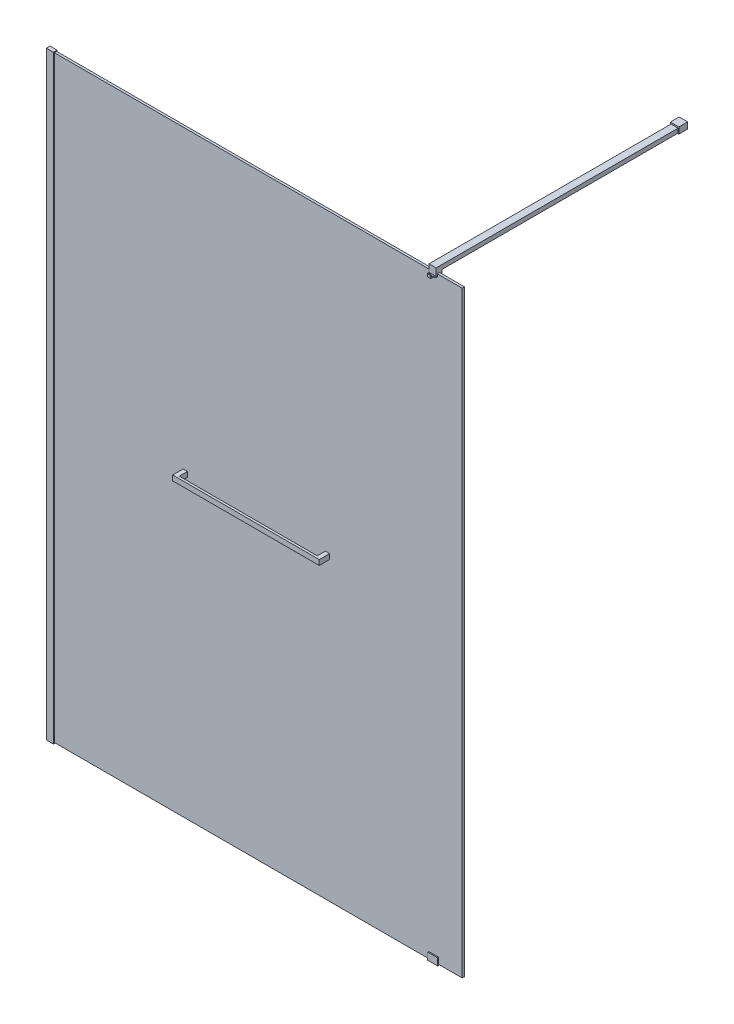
SolidWorks part; units mm, degrees
ref_plane "Płaszczyzna przednia" through (0, 0, 0) normal (0, 0, 1) x (1, 0, 0)
ref_plane "Płaszczyzna górna" through (0, 0, 0) normal (0, 1, 0) x (1, 0, 0)
ref_plane "Płaszczyzna prawa" through (0, 0, 0) normal (1, 0, 0) x (0, 0, -1)
sketch "Szkic1" plane through (0, 0, 0) normal (0, 1, 0) x (1, 0, 0)
  line L0 (0, 0) -> (0, 13.3)
  line L2 (0, 13.3) -> (25, 13.3)
  line L3 (25, 13.3) -> (25, 11.4)
  line L4 (25, 11.4) -> (11.45, 11.4)
  line L5 (11.45, 11.4) -> (11.45, 3.4)
  line L6 (11.45, 3.4) -> (25, 3.4)
  line L7 (25, 3.4) -> (25, 0)
  line L8 (25, 0) -> (0, 0)
  dimension "D1" = 13.3
  dimension "D4" = 1.9
  dimension "D5" = 8
  dimension "D6" = 3.4
  dimension "D7" = 13.55
  dimension "D8" = 25
extrude "Dodanie-wyciągnięcie1" add sketch "Szkic1" along normal blind 2100
sketch "Szkic2" plane through (0, 0, 0) normal (0, -1, 0) x (1, 0, 0)
  line L0 (11.45, -3.4) -> (1458.45, -3.4)
  line L1 (11.45, -3.4) -> (11.45, -11.4)
  line L2 (1458.45, -3.4) -> (1458.45, -11.4)
  line L3 (11.45, -11.4) -> (1458.45, -11.4)
  line L4 (11.45, -11.4) -> (25, -11.4) construction
  dimension "D1" = 1447
extrude "Dodanie-wyciągnięcie2" add sketch "Szkic2" against normal blind 2100 separate body
sketch "Szkic4" plane through (0, 2100, 0) normal (0, 1, 0) x (1, 0, 0)
  line L1 (25, 13.3) -> (0, 13.3) construction
  line L2 (25, 11.4) -> (25, 13.3) construction
  line L3 (0, 13.3) -> (0, 0) construction
  line L5 (0, 0) -> (25, 0) construction
  line L7 (25, 13.3) -> (0, 13.3)
  line L8 (25, 0) -> (25, 13.3)
  line L9 (0, 13.3) -> (0, 0)
  line L11 (0, 0) -> (25, 0)
extrude "Dodanie-wyciągnięcie3" add sketch "Szkic4" along normal blind 3
sketch "Szkic5" plane through (0, 0, 0) normal (0, -1, 0) x (1, 0, 0)
  line L1 (0, 0) -> (25, 0) construction
  line L2 (25, 0) -> (25, -3.4) construction
  line L3 (0, -13.3) -> (0, 0) construction
  line L5 (25, -13.3) -> (0, -13.3) construction
  line L7 (0, 0) -> (25, 0)
  line L8 (25, 0) -> (25, -13.3)
  line L9 (0, -13.3) -> (0, 0)
  line L11 (25, -13.3) -> (0, -13.3)
extrude "Dodanie-wyciągnięcie4" add sketch "Szkic5" along normal blind 3
ref_plane "Płaszczyzna1" through (1358.45, 0, 0) normal (1, 0, 0) x (0, 0, -1)
sketch "Szkic6" plane through (1358.45, 0, 0) normal (1, 0, 0) x (0, 0, -1)
  line L0 (11.4, 22) -> (15.75, 22)
  line L1 (15.75, 22) -> (15.75, -3)
  line L2 (15.75, -3) -> (-0.35, -3)
  line L3 (-0.35, -3) -> (-0.35, 22)
  line L4 (-0.35, 22) -> (3.4, 22)
  line L5 (11.4, 22) -> (11.4, 0)
  line L6 (11.4, 0) -> (11.4, 2100)
  line L7 (11.4, 0) -> (11.4, 2100) construction
  line L8 (3.4, 2100) -> (3.4, 0)
  line L9 (3.4, 2100) -> (3.4, 0) construction
  line L10 (11.4, 0) -> (3.4, 0)
  line L11 (3.4, 0) -> (3.4, 22)
  dimension "D1" = 4.35
  dimension "D2" = 25
  dimension "D3" = 3
  dimension "D4" = 3.75
extrude "Dodanie-wyciągnięcie5" add sketch "Szkic6" along normal mid plane 35 separate body
sketch "Szkic7" plane through (1358.45, 0, 0) normal (1, 0, 0) x (0, 0, -1)
  line L0 (3.4, 2100) -> (3.4, 0) construction
  line L1 (-0.6, 2120) -> (19.4, 2120)
  line L2 (3.4, 2100) -> (3.4, 0) construction
  line L4 (11.4, 2100) -> (3.4, 2100) construction
  line L13 (11.4, 2100) -> (11.4, 0) construction
  line L20 (19.4, 2120) -> (19.4, 2090)
  line L25 (19.4, 2090) -> (11.4, 2090)
  line L26 (11.4, 2090) -> (11.4, 2100)
  line L27 (11.4, 2100) -> (3.4, 2100)
  line L28 (3.4, 2100) -> (3.4, 2090)
  line L29 (3.4, 2090) -> (-13.37, 2090)
  line L30 (-13.37, 2090) -> (-13.37, 2100)
  line L31 (-13.37, 2100) -> (-10.37, 2100)
  line L32 (-10.37, 2100) -> (-9.8451, 2094)
  line L33 (-9.8451, 2094) -> (-0.6, 2094)
  line L34 (-0.6, 2094) -> (-0.6, 2120)
  dimension "D3" = 20
  dimension "D4" = 30
  dimension "D5" = 16.77
  dimension "D6" = 4
  dimension "D14" = 8
  dimension "D21" = 10
  dimension "D22" = 4
  dimension "D23" = 3
  dimension "D24" = 95
extrude "Dodanie-wyciągnięcie6" add sketch "Szkic7" along normal mid plane 25 separate body
sketch "Szkic8" plane through (0, 2100, 0) normal (0, 1, 0) x (1, 0, 0)
  line L0 (1345.95, -0.6) -> (1352.45, -3.631)
  line L1 (1352.45, -3.631) -> (1352.45, -13.37)
  line L2 (1370.95, -0.6) -> (1364.45, -3.631)
  line L3 (1364.45, -3.631) -> (1364.45, -13.37)
  line L4 (1358.45, -10.37) -> (1358.45, 156.6902) construction
  line L5 (1370.95, -10.37) -> (1345.95, -10.37) construction
  line L6 (1352.45, -13.37) -> (1364.45, -13.37)
  line L7 (1370.95, -13.37) -> (1345.95, -13.37) construction
  dimension "D1" = 12
  dimension "D2" = 115
extrude "Wytnij-wyciągnięcie1" cut sketch "Szkic8" against normal through all and the other way through all
sketch "Szkic10" plane through (0, 2120, 0) normal (0, 1, 0) x (1, 0, 0)
  line L0 (1358.45, 31.9) -> (1358.45, 19.4) construction
  line L1 (1345.95, 881.03) -> (1370.95, 881.03)
  line L2 (1345.95, 881.03) -> (1345.95, 19.4)
  line L3 (1345.95, 19.4) -> (1370.95, 19.4)
  line L4 (1370.95, 19.4) -> (1345.95, 19.4) construction
  line L5 (1345.95, 19.4) -> (1345.95, -0.6) construction
  line L6 (1370.95, 881.03) -> (1370.95, 19.4)
  point P4 (1358.45, 31.9)
  dimension "D2" = 861.63
  dimension "D1" = 25
  dimension "D3" = 12.5
extrude "Dodanie-wyciągnięcie7" add sketch "Szkic10" against normal blind 15
sketch "Szkic14" plane through (0, 0, -881.03) normal (0, 0, -1) x (-1, 0, 0)
  line L1 (-1373.45, 2125) -> (-1343.45, 2125)
  line L2 (-1373.45, 2125) -> (-1373.45, 2103)
  line L3 (-1373.45, 2103) -> (-1343.45, 2103)
  line L4 (-1343.45, 2125) -> (-1343.45, 2103)
  line L5 (-1373.45, 2125) -> (-1343.45, 2103) construction
  line L6 (-1373.45, 2103) -> (-1343.45, 2125) construction
  line L7 (-1358.45, 2120) -> (-1358.45, 2114) construction
  line L8 (-1370.95, 2120) -> (-1345.95, 2120) construction
  line L9 (-1370.95, 2105) -> (-1345.95, 2105) construction
  point P0 (-1358.45, 2114)
  dimension "D1" = 30
  dimension "D2" = 22
  dimension "D3" = 2
extrude "Dodanie-wyciągnięcie8" add sketch "Szkic14" against normal blind 31
sketch "Szkic17" plane through (0, 0, -3.4) normal (0, 0, 1) x (1, 0, 0)
  line L0 (734.95, 2100) -> (734.95, 1050) construction
  line L1 (1458.45, 2100) -> (11.45, 2100) construction
  line L2 (734.95, 1050) -> (734.95, 0) construction
  line L3 (1458.45, 0) -> (11.45, 0) construction
  line L4 (484.95, 1050) -> (984.95, 1050) construction
  line L6 (477.45, 1059) -> (492.45, 1059)
  line L7 (477.45, 1059) -> (477.45, 1041)
  line L8 (477.45, 1041) -> (492.45, 1041)
  line L9 (492.45, 1059) -> (492.45, 1041)
  line L10 (477.45, 1059) -> (492.45, 1041) construction
  line L11 (477.45, 1041) -> (492.45, 1059) construction
  line L12 (977.45, 1059) -> (992.45, 1059)
  line L13 (977.45, 1059) -> (977.45, 1041)
  line L14 (977.45, 1041) -> (992.45, 1041)
  line L15 (992.45, 1059) -> (992.45, 1041)
  line L16 (977.45, 1059) -> (992.45, 1041) construction
  line L17 (977.45, 1041) -> (992.45, 1059) construction
  dimension "D1" = 500
  dimension "D2" = 15
  dimension "D3" = 18
extrude "polka_1a" add sketch "Szkic17" along normal blind 36.5 and the other way blind 31 separate body
sketch "Szkic18" plane through (477.45, 0, 0) normal (-1, 0, 0) x (0, 0, 1)
  line L0 (-34.4, 1059) -> (-34.4, 1041) construction
  line L1 (-34.4, 1053.73) -> (-21.6, 1053.73)
  line L2 (-34.4, 1053.73) -> (-34.4, 1045.73)
  line L3 (-34.4, 1045.73) -> (-21.6, 1045.73)
  line L4 (-21.6, 1053.73) -> (-21.6, 1045.73)
  line L5 (-34.4, 1041) -> (33.1, 1041) construction
  dimension "D1" = 4.73
  dimension "D2" = 8
  dimension "D3" = 12.8
extrude "polka_1b" cut sketch "Szkic18" against normal up to surface (515 mm away)
sketch "Szkic19" plane through (0, 1059, 0) normal (0, 1, 0) x (1, 0, 0)
  line L0 (992.45, 21.6) -> (477.45, 21.6)
  line L1 (992.45, 21.6) -> (992.45, 101.6)
  line L2 (477.45, 21.6) -> (477.45, 101.6)
  line L3 (992.45, 101.6) -> (477.45, 101.6)
  line L4 (992.45, 34.4) -> (992.45, -33.1) construction
  line L5 (477.45, 34.4) -> (477.45, -33.1) construction
  line L6 (11.45, 11.4) -> (1458.45, 11.4) construction
  dimension "D1" = 10.2
  dimension "D2" = 80
extrude "polka_1c" add sketch "Szkic19" against normal blind 8 from offset 5.28 separate body
sketch "Szkic20" plane through (492.45, 0, 0) normal (1, 0, 0) x (0, 0, -1)
  line L0 (34.4, 1041) -> (-33.1, 1041) construction
  line L1 (-33.1, 1059) -> (-25.1, 1059)
  line L2 (-33.1, 1059) -> (-33.1, 1041)
  line L3 (-33.1, 1041) -> (-25.1, 1041)
  line L4 (-25.1, 1059) -> (-25.1, 1041)
  dimension "D1" = 8
extrude "polka_1d" add sketch "Szkic20" along normal up to surface (485 mm away)
